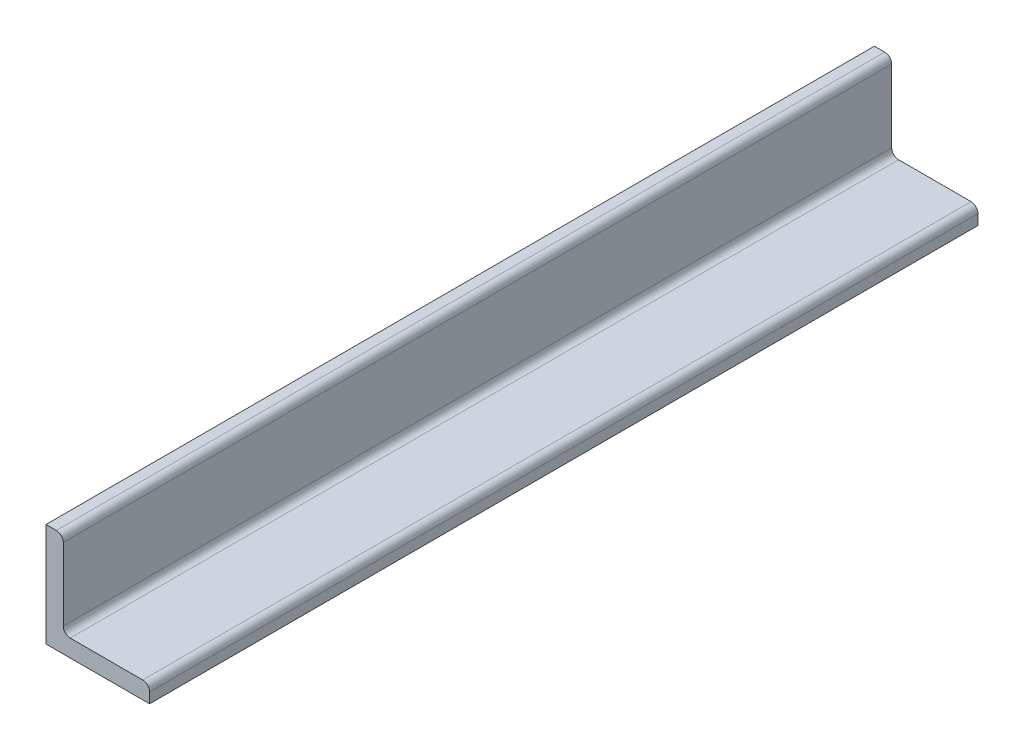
SolidWorks part; units mm, degrees
ref_plane "Plane1" through (0, 0, 0) normal (0, 0, 1) x (1, 0, 0)
ref_plane "Plane2" through (0, 0, 0) normal (0, 1, 0) x (1, 0, 0)
ref_plane "Plane3" through (0, 0, 0) normal (1, 0, 0) x (0, 0, -1)
sketch "Sketch1" plane through (0, 0, 0) normal (0, 0, 1) x (1, 0, 0)
  line L0 (0, 38.1) -> (0, 0)
  line L1 (0, 0) -> (38.1, 0)
  line L2 (6.35, 6.35) -> (38.1, 6.35)
  line L3 (6.35, 38.1) -> (6.35, 6.35)
  line L4 (0, 38.1) -> (6.35, 38.1)
  line L5 (38.1, 0) -> (38.1, 6.35)
  dimension "D2" = 38.1
  dimension "D3" = 38.1
  dimension "D1" = 6.35
extrude "Base-Extrude" add sketch "Sketch1" along normal blind 304.8
fillet "Fillet1" radius 2.54
fillet "Fillet2" radius 2.54
fillet "Fillet3" radius 2.54
